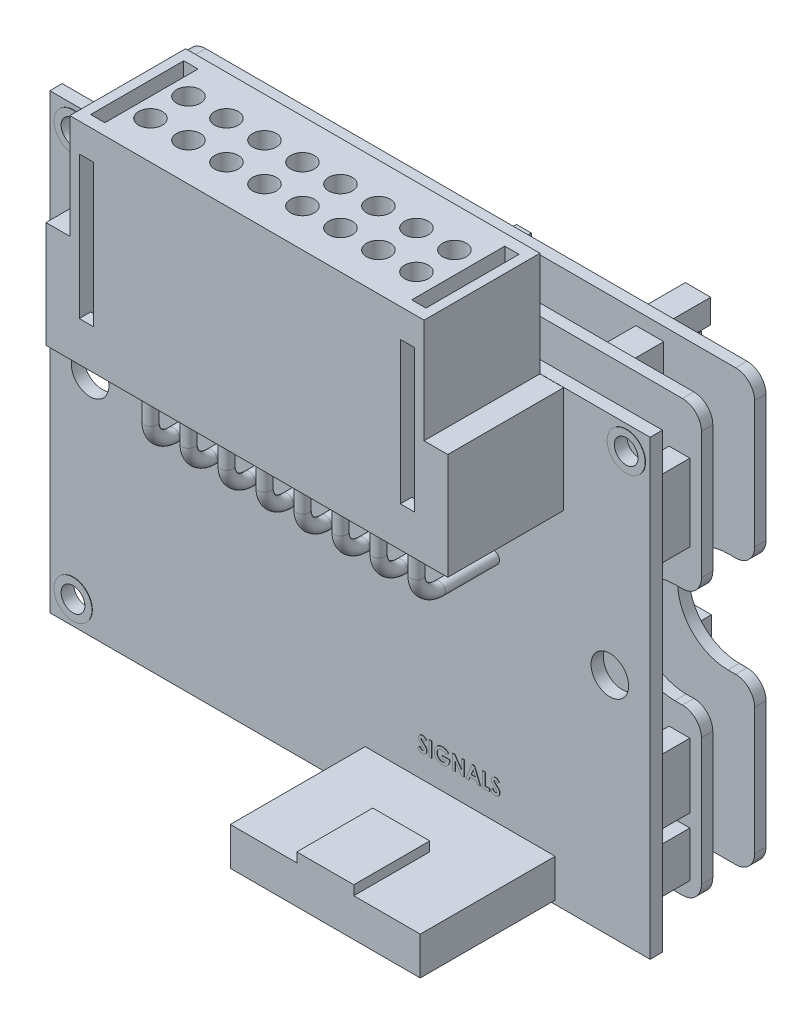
SolidWorks part; units mm, degrees
ref_plane "Front" through (0, 0, 0) normal (0, 0, 1) x (1, 0, 0)
ref_plane "Top" through (0, 0, 0) normal (0, 1, 0) x (1, 0, 0)
ref_plane "Right" through (0, 0, 0) normal (1, 0, 0) x (0, 0, -1)
sketch "Sketch1" plane through (0, 0, 0) normal (0, 0, 1) x (1, 0, 0)
  line L0 (-37.465, -27.4574) -> (37.465, 27.4574) construction
  line L1 (-37.465, 29.9974) -> (37.465, 29.9974)
  line L2 (-40.005, 27.4574) -> (-40.005, -27.4574)
  line L3 (-37.465, -29.9974) -> (37.465, -29.9974)
  line L4 (40.005, 27.4574) -> (40.005, -27.4574)
  arc A0 (-40.005, 27.4574) -> (-37.465, 29.9974) centre (-37.465, 27.4574) cw
  arc A1 (40.005, 27.4574) -> (37.465, 29.9974) centre (37.465, 27.4574) ccw
  arc A2 (37.465, -29.9974) -> (40.005, -27.4574) centre (37.465, -27.4574) ccw
  arc A3 (-40.005, -27.4574) -> (-37.465, -29.9974) centre (-37.465, -27.4574) ccw
  point P6 (-40.005, 29.9974)
  point P12 (40.005, -29.9974)
  dimension "D3" = 2.54
  dimension "D1" = 59.9948
  dimension "D2" = 80.01
extrude "Base-Extrude" add sketch "Sketch1" along normal blind 3.048
sketch "Sketch2" plane through (0, 0, 3.048) normal (0, 0, 1) x (1, 0, 0)
  line L0 (-42.4859, 0) -> (42.2921, 0) construction
  line L1 (0, 33.2814) -> (0, -31.4405) construction
  circle A0 centre (-34.7472, 0) radius 2.2479
  circle A1 centre (34.7472, 0) radius 2.2479
  dimension "D1" = 4.4958
  dimension "D2" = 69.4944
extrude "Cut-Extrude1" cut sketch "Sketch2" against normal up to next
sketch "Sketch3" plane through (0, 0, 3.048) normal (0, 0, 1) x (1, 0, 0)
  line L1 (-21.7516, 17.5854) -> (-18.6512, 17.5854)
  line L2 (-21.7516, 17.5854) -> (-21.7516, 14.8725)
  line L3 (-21.7516, 14.8725) -> (-18.6512, 14.8725)
  line L4 (-18.6512, 17.5854) -> (-18.6512, 14.8725)
  line L5 (-21.7516, -0.8236) -> (-18.748, -0.8236)
  line L6 (-21.7516, -0.8236) -> (-21.7516, -3.8271)
  line L7 (-21.7516, -3.8271) -> (-18.748, -3.8271)
  line L8 (-18.748, -0.8236) -> (-18.748, -3.8271)
  line L9 (-21.7516, -12.2565) -> (-18.5543, -12.2565)
  line L10 (-21.7516, -12.2565) -> (-21.7516, -15.3569)
  line L11 (-21.7516, -15.3569) -> (-18.5543, -15.3569)
  line L12 (-18.5543, -12.2565) -> (-18.5543, -15.3569)
  line L13 (-21.7516, -21.0734) -> (-18.4574, -21.0734)
  line L14 (-21.7516, -21.0734) -> (-21.7516, -24.2707)
  line L15 (-21.7516, -24.2707) -> (-18.4574, -24.2707)
  line L16 (-18.4574, -21.0734) -> (-18.4574, -24.2707)
  line L17 (-1.9862, 22.0423) -> (0, 22.0423)
  line L18 (-1.9862, 22.0423) -> (-1.9862, 16.2289)
  line L19 (-1.9862, 16.2289) -> (0, 16.2289)
  line L20 (0, 22.0423) -> (0, 16.2289)
  line L21 (-1.9862, 2.18) -> (0, 2.18)
  line L22 (-1.9862, 2.18) -> (-1.9862, -4.6991)
  line L23 (-1.9862, -4.6991) -> (0, -4.6991)
  line L24 (0, 2.18) -> (0, -4.6991)
  line L25 (-1.9862, -17.004) -> (0, -17.004)
  line L26 (-1.9862, -17.004) -> (-1.9862, -23.4956)
  line L27 (-1.9862, -23.4956) -> (0, -23.4956)
  line L28 (0, -17.004) -> (0, -23.4956)
  line L29 (20.5889, 26.5961) -> (23.9801, 26.5961)
  line L30 (20.5889, 26.5961) -> (20.5889, 23.3987)
  line L31 (20.5889, 23.3987) -> (23.9801, 23.3987)
  line L32 (23.9801, 26.5961) -> (23.9801, 23.3987)
  line L33 (20.6858, 11.3845) -> (24.3676, 11.3845)
  line L34 (20.6858, 11.3845) -> (20.6858, 8.1871)
  line L35 (20.6858, 8.1871) -> (24.3676, 8.1871)
  line L36 (24.3676, 11.3845) -> (24.3676, 8.1871)
  line L37 (20.6858, 1.7924) -> (22.4298, 1.7924)
  line L38 (20.6858, 1.7924) -> (20.6858, -4.796)
  line L39 (20.6858, -4.796) -> (22.4298, -4.796)
  line L40 (22.4298, 1.7924) -> (22.4298, -4.796)
  line L41 (20.6858, -10.1249) -> (24.0769, -10.1249)
  line L42 (20.6858, -10.1249) -> (20.6858, -13.2254)
  line L43 (20.6858, -13.2254) -> (24.0769, -13.2254)
  line L44 (24.0769, -10.1249) -> (24.0769, -13.2254)
  line L45 (20.6858, -16.6165) -> (22.4298, -16.6165)
  line L46 (20.6858, -16.6165) -> (20.6858, -23.3987)
  line L47 (20.6858, -23.3987) -> (22.4298, -23.3987)
  line L48 (22.4298, -16.6165) -> (22.4298, -23.3987)
  line L49 (20.6858, 22.0423) -> (22.7205, 22.0423)
  line L50 (20.6858, 22.0423) -> (20.6858, 14.8725)
  line L51 (20.6858, 14.8725) -> (22.7205, 14.8725)
  line L52 (22.7205, 22.0423) -> (22.7205, 14.8725)
extrude "Boss-Extrude1" add sketch "Sketch3" along normal blind 6.858
sketch "Sketch4" plane through (0, 0, 9.906) normal (0, 0, 1) x (1, 0, 0)
  line L0 (37.465, 29.9974) -> (-37.465, 29.9974) construction
  line L1 (-36.703, 28.4734) -> (35.687, 28.4734)
  line L2 (-39.243, 25.9334) -> (-39.243, 8.9789)
  line L3 (-36.703, -29.0576) -> (35.687, -29.0576)
  line L4 (38.227, 25.9334) -> (38.227, 8.9789)
  line L5 (-40.005, 27.4574) -> (-40.005, -27.4574) construction
  line L6 (-39.3065, -0.2921) -> (38.1635, -0.2921) construction
  line L7 (-36.703, 6.4389) -> (-35.687, 6.4389)
  line L8 (-36.703, -7.0231) -> (-35.687, -7.0231)
  line L9 (-39.243, -9.5631) -> (-39.243, -26.5176)
  line L10 (-0.508, 32.9907) -> (-0.508, -31.6343) construction
  line L11 (35.687, -7.0231) -> (34.671, -7.0231)
  line L12 (35.687, 6.4389) -> (34.671, 6.4389)
  line L13 (38.227, -9.5631) -> (38.227, -26.5176)
  arc A0 (-35.687, -7.0231) -> (-35.687, 6.4389) centre (-35.687, -0.2921) ccw
  arc A1 (-36.703, 6.4389) -> (-39.243, 8.9789) centre (-36.703, 8.9789) cw
  arc A2 (-36.703, 28.4734) -> (-39.243, 25.9334) centre (-36.703, 25.9334) ccw
  arc A3 (38.227, 25.9334) -> (35.687, 28.4734) centre (35.687, 25.9334) ccw
  arc A4 (35.687, -29.0576) -> (38.227, -26.5176) centre (35.687, -26.5176) ccw
  arc A5 (-39.243, -9.5631) -> (-36.703, -7.0231) centre (-36.703, -9.5631) cw
  arc A6 (-36.703, -29.0576) -> (-39.243, -26.5176) centre (-36.703, -26.5176) cw
  arc A7 (38.227, -9.5631) -> (35.687, -7.0231) centre (35.687, -9.5631) ccw
  arc A8 (34.671, -7.0231) -> (34.671, 6.4389) centre (34.671, -0.2921) cw
  arc A9 (35.687, 6.4389) -> (38.227, 8.9789) centre (35.687, 8.9789) ccw
  point P17 (-39.243, 6.4389)
  point P26 (-39.243, -7.0231)
  dimension "D8" = 2.54
  dimension "D9" = 2.54
  dimension "D1" = 1.524
  dimension "D2" = 0.762
  dimension "D3" = 57.531
  dimension "D4" = 77.47
  dimension "D5" = 3.556
  dimension "D6" = 13.462
  dimension "D7" = 28.7655
  dimension "D10" = 10.287
extrude "Boss-Extrude2" add sketch "Sketch4" along normal blind 1.524
sketch "Sketch5" plane through (0, 0, 11.43) normal (0, 0, 1) x (1, 0, 0)
  line L1 (-38.6103, 22.3329) -> (-35.413, 22.3329)
  line L2 (-38.6103, 22.3329) -> (-38.6103, 19.2325)
  line L3 (-38.6103, 19.2325) -> (-35.413, 19.2325)
  line L4 (-35.413, 22.3329) -> (-35.413, 19.2325)
  line L5 (-38.6103, 14.5818) -> (-35.5099, 14.5818)
  line L6 (-38.6103, 14.5818) -> (-38.6103, 11.3845)
  line L7 (-38.6103, 11.3845) -> (-35.5099, 11.3845)
  line L8 (-35.5099, 14.5818) -> (-35.5099, 11.3845)
  line L9 (-38.6103, -10.7872) -> (-35.6068, -10.7872)
  line L10 (-38.6103, -10.7872) -> (-38.6103, -13.7908)
  line L11 (-38.6103, -13.7908) -> (-35.6068, -13.7908)
  line L12 (-35.6068, -10.7872) -> (-35.6068, -13.7908)
  line L13 (-38.6103, -16.6165) -> (-35.7036, -16.6165)
  line L14 (-38.6103, -16.6165) -> (-38.6103, -19.5232)
  line L15 (-38.6103, -19.5232) -> (-35.7036, -19.5232)
  line L16 (-35.7036, -16.6165) -> (-35.7036, -19.5232)
  line L17 (-38.6103, -22.1392) -> (-35.8005, -22.1392)
  line L18 (-38.6103, -22.1392) -> (-38.6103, -25.7144)
  line L19 (-38.6103, -25.7144) -> (-35.8005, -25.7144)
  line L20 (-35.8005, -22.1392) -> (-35.8005, -25.7144)
  line L21 (-4.1579, 2.6483) -> (3.0273, 2.6483)
  line L22 (-4.1579, 2.6483) -> (-4.1579, -1.3149)
  line L23 (-4.1579, -1.3149) -> (3.0273, -1.3149)
  line L24 (3.0273, 2.6483) -> (3.0273, -1.3149)
  line L25 (-4.1579, -27.6618) -> (0.7703, -27.6618)
  line L26 (-4.1579, -27.6618) -> (-4.1579, -24.1023)
  line L27 (-4.1579, -24.1023) -> (0.7703, -24.1023)
  line L28 (0.7703, -27.6618) -> (0.7703, -24.1023)
  line L29 (24.7642, -27.565) -> (27.875, -27.565)
  line L30 (24.7642, -27.565) -> (24.7642, -24.1023)
  line L31 (24.7642, -24.1023) -> (27.875, -24.1023)
  line L32 (27.875, -27.565) -> (27.875, -24.1023)
  line L33 (22.3582, 26.6875) -> (26.0708, 26.6875)
  line L34 (22.3582, 26.6875) -> (22.3582, 22.6236)
  line L35 (22.3582, 22.6236) -> (26.0708, 22.6236)
  line L36 (26.0708, 26.6875) -> (26.0708, 22.6236)
extrude "Boss-Extrude3" add sketch "Sketch5" along normal blind 5.588
pattern_linear "LPattern1" count 2 spacing 7.112
sketch "Sketch6" plane through (0, 0, 18.542) normal (0, 0, 1) x (1, 0, 0)
  line L1 (-33.9596, 20.4921) -> (-30.8592, 20.4921)
  line L2 (-33.9596, 20.4921) -> (-33.9596, 12.644)
  line L3 (-33.9596, 12.644) -> (-30.8592, 12.644)
  line L4 (-30.8592, 20.4921) -> (-30.8592, 12.644)
  line L5 (-33.9596, -10.3592) -> (-30.8592, -10.3592)
  line L6 (-33.9596, -10.3592) -> (-33.9596, -24.1372)
  line L7 (-33.9596, -24.1372) -> (-30.8592, -24.1372)
  line L8 (-30.8592, -10.3592) -> (-30.8592, -24.1372)
  line L9 (36.687, 22.0601) -> (33.9093, 22.0601)
  line L10 (36.687, 22.0601) -> (36.687, 11.7833)
  line L11 (36.687, 11.7833) -> (33.9093, 11.7833)
  line L12 (33.9093, 22.0601) -> (33.9093, 11.7833)
  line L13 (36.687, -10.3592) -> (33.9093, -10.3592)
  line L14 (36.687, -10.3592) -> (36.687, -19.0173)
  line L15 (36.687, -19.0173) -> (33.9093, -19.0173)
  line L16 (33.9093, -10.3592) -> (33.9093, -19.0173)
  line L17 (33.9093, -20.7669) -> (36.687, -20.7669)
  line L18 (33.9093, -20.7669) -> (33.9093, -26.8595)
  line L19 (33.9093, -26.8595) -> (36.687, -26.8595)
  line L20 (36.687, -20.7669) -> (36.687, -26.8595)
extrude "Boss-Extrude4" add sketch "Sketch6" along normal blind 6.985
sketch "Sketch7" plane through (0, 0, 25.527) normal (0, 0, 1) x (1, 0, 0)
  line L1 (-40.259, 30.4546) -> (40.005, 30.4546)
  line L2 (-40.259, 30.4546) -> (-40.259, -29.9974)
  line L3 (-40.259, -29.9974) -> (40.005, -29.9974)
  line L4 (40.005, 30.4546) -> (40.005, -29.9974)
  line L6 (40.005, -27.4574) -> (40.005, 27.4574) construction
  line L7 (-37.465, -29.9974) -> (37.465, -29.9974) construction
  dimension "D1" = 60.452
  dimension "D2" = 80.264
extrude "Boss-Extrude5" add sketch "Sketch7" along normal blind 1.651
sketch "Sketch8" plane through (0, 0, 27.178) normal (0, 0, 1) x (1, 0, 0)
  line L0 (-40.259, 0.2286) -> (40.005, 0.2286) construction
  line L1 (-40.259, 30.4546) -> (-40.259, -29.9974) construction
  line L2 (40.005, -29.9974) -> (40.005, 30.4546) construction
  line L3 (-0.127, 30.4546) -> (-0.127, -29.9974) construction
  line L4 (40.005, 30.4546) -> (-40.259, 30.4546) construction
  line L5 (-40.259, -29.9974) -> (40.005, -29.9974) construction
  circle A0 centre (-34.8742, 0.2286) radius 2.5146
  circle A1 centre (34.6202, 0.2286) radius 2.5146
  dimension "D1" = 5.0292
  dimension "D2" = 69.4944
extrude "Cut-Extrude2" cut sketch "Sketch8" against normal up to next
sketch "Sketch9" plane through (0, 0, 27.178) normal (0, 0, 1) x (1, 0, 0)
  line L0 (40.005, 30.4546) -> (-40.259, 30.4546) construction
  line L1 (-25.273, 30.4292) -> (28.448, 30.4292)
  line L2 (-25.273, 30.4292) -> (-25.273, 16.2052)
  line L3 (-25.273, 16.2052) -> (28.448, 16.2052)
  line L4 (28.448, 30.4292) -> (28.448, 16.2052)
  line L5 (-40.259, 30.4546) -> (-40.259, -29.9974) construction
  dimension "D1" = 0.0254
  dimension "D2" = 53.721
  dimension "D3" = 14.224
  dimension "D4" = 14.986
extrude "Boss-Extrude6" add sketch "Sketch9" along normal blind 15.494
sketch "Sketch10" plane through (0, 30.4292, 0) normal (0, 1, 0) x (-1, 0, 0)
  line L1 (-28.448, 42.672) -> (25.273, 42.672) construction
  line L3 (-25.273, 42.672) -> (22.098, 42.672)
  line L4 (-25.273, 42.672) -> (-25.273, 27.178)
  line L5 (-25.273, 27.178) -> (22.098, 27.178)
  line L6 (22.098, 42.672) -> (22.098, 27.178)
  line L7 (25.273, 27.178) -> (-28.448, 42.672) construction
  line L8 (-25.273, 27.178) -> (22.098, 42.672) construction
  point P8 (-1.5875, 34.925)
  dimension "D1" = 47.371
extrude "Boss-Extrude7" add sketch "Sketch10" along normal blind 13.97
ref_plane "Plane1" through (19.05, 0, 0) normal (1, 0, 0) x (0, 0, -1)
sketch "Sketch11" plane through (19.05, 0, 0) normal (1, 0, 0) x (0, 0, -1)
  line L0 (-37.465, 16.2052) -> (-37.465, 9.1694)
  line L1 (-42.672, 16.2052) -> (-27.178, 16.2052) construction
  line L2 (-34.417, 6.1214) -> (-27.178, 6.1214)
  line L3 (-27.178, -29.9974) -> (-27.178, 30.4546) construction
  line L4 (-42.672, 16.2052) -> (-42.672, 30.4292) construction
  arc A0 (-34.417, 6.1214) -> (-37.465, 9.1694) centre (-34.417, 9.1694) cw
  dimension "D3" = 3.048
  dimension "D1" = 5.207
  dimension "D2" = 10.0838
sketch "Sketch12" plane through (0, 16.2052, 0) normal (0, -1, 0) x (1, 0, 0)
  circle A0 centre (19.05, 37.465) radius 0.8128
  dimension "D1" = 1.6256
sweep "Boss-Sweep1" add profiles "Sketch12" path "Sketch11"
sketch "Sketch13" plane through (19.05, 0, 0) normal (1, 0, 0) x (0, 0, -1)
  line L0 (-32.385, 16.2052) -> (-32.385, 14.2494)
  line L1 (-42.672, 16.2052) -> (-27.178, 16.2052) construction
  line L2 (-29.337, 11.2014) -> (-27.178, 11.2014)
  line L3 (-27.178, -29.9974) -> (-27.178, 30.4546) construction
  line L4 (-34.417, 6.1214) -> (-27.178, 6.1214) construction
  line L5 (-37.465, 9.1694) -> (-37.465, 16.2052) construction
  arc A0 (-29.337, 11.2014) -> (-32.385, 14.2494) centre (-29.337, 14.2494) cw
  dimension "D3" = 3.048
  dimension "D1" = 5.08
  dimension "D2" = 5.08
sketch "Sketch14" plane through (0, 16.2052, 0) normal (0, -1, 0) x (1, 0, 0)
  circle A0 centre (19.05, 32.385) radius 0.8128
  dimension "D1" = 1.6256
pattern_linear "LPattern2" count 8 spacing 5.08
sweep "Boss-Sweep2" add profiles "Sketch14" path "Sketch13"
pattern_linear "LPattern3" count 8 spacing 5.08
sketch "Sketch16" plane through (0, 0, 27.178) normal (0, 0, 1) x (1, 0, 0)
  line L0 (40.005, -29.9974) -> (40.005, 30.4546) construction
  line L1 (1.905, -24.4094) -> (27.305, -24.4094)
  line L2 (1.905, -24.4094) -> (1.905, -29.4894)
  line L3 (1.905, -29.4894) -> (27.305, -29.4894)
  line L4 (27.305, -24.4094) -> (27.305, -29.4894)
  line L5 (-40.259, -29.9974) -> (40.005, -29.9974) construction
  dimension "D1" = 5.08
  dimension "D2" = 25.4
  dimension "D3" = 12.7
  dimension "D4" = 0.508
extrude "Boss-Extrude8" add sketch "Sketch16" along normal blind 18.034
sketch "Sketch17" plane through (0, 0, 45.212) normal (0, 0, 1) x (1, 0, 0)
  line L0 (14.605, -29.4894) -> (14.605, -19.0816) construction
  line L1 (27.305, -24.4094) -> (1.905, -24.4094) construction
  line L3 (18.415, -24.4094) -> (10.795, -24.4094)
  line L4 (10.795, -24.4094) -> (10.795, -23.1394)
  line L5 (10.795, -23.1394) -> (18.415, -23.1394)
  line L6 (1.905, -29.4894) -> (27.305, -29.4894) construction
  line L7 (18.415, -24.4094) -> (18.415, -23.1394)
  point P11 (14.605, -23.1394)
  point P12 (14.605, -24.4094)
  dimension "D1" = 7.62
  dimension "D2" = 1.27
extrude "Boss-Extrude9" add sketch "Sketch17" against normal blind 10.16
sketch "Sketch18" plane through (0, 0, 27.178) normal (0, 0, 1) x (1, 0, 0)
  line L0 (40.005, 0.2286) -> (-40.259, 0.2286) construction
  line L1 (40.005, -29.9974) -> (40.005, 30.4546) construction
  line L2 (-40.259, 30.4546) -> (-40.259, -29.9974) construction
  line L3 (-0.127, -29.9974) -> (-0.127, 49.4652) construction
  line L4 (-40.259, -29.9974) -> (40.005, -29.9974) construction
  circle A0 centre (-37.1094, 27.2796) radius 1.5875
  circle A1 centre (-37.1094, -26.8224) radius 1.5875
  circle A2 centre (36.8554, 27.2796) radius 1.5875
  dimension "D1" = 3.175
  dimension "D2" = 54.102
  dimension "D3" = 73.9648
extrude "Cut-Extrude3" cut sketch "Sketch18" against normal up to next
sketch "Sketch19" plane through (0, 0, 27.178) normal (0, 0, 1) x (1, 0, 0)
  circle A0 centre (36.8554, 27.2796) radius 1.5875 construction
  circle A1 centre (-37.1094, -26.8224) radius 1.5875 construction
  circle A2 centre (-37.1094, 27.2796) radius 1.5875 construction
  circle A18 centre (36.8554, 27.2796) radius 1.5875
  circle A19 centre (-37.1094, -26.8224) radius 1.5875
  circle A20 centre (-37.1094, 27.2796) radius 1.5875
  circle A21 centre (-37.1094, 27.2796) radius 2.54
  circle A22 centre (-37.1094, -26.8224) radius 2.54
  circle A23 centre (36.8554, 27.2796) radius 2.54
  dimension "D1" = 5.08
extrude "Boss-Extrude10" add sketch "Sketch19" along normal blind 0.0508
sketch "Sketch20" plane through (0, 44.3992, 0) normal (0, 1, 0) x (-1, 0, 0)
  line L0 (22.098, 42.672) -> (-25.273, 42.672) construction
  line L2 (-25.273, 42.672) -> (-25.273, 27.178) construction
  circle A0 centre (-19.177, 37.592) radius 1.5875
  dimension "D1" = 3.175
  dimension "D2" = 5.08
  dimension "D3" = 6.096
extrude "Cut-Extrude4" cut sketch "Sketch20" against normal blind 25.4
pattern_linear "LPattern4" count 8 spacing 5.08 count 2 spacing 5.08
sketch "Sketch21" plane through (0, 44.3992, 0) normal (0, 1, 0) x (-1, 0, 0)
  line L0 (-25.273, 42.672) -> (-25.273, 27.178) construction
  line L1 (-24.003, 28.702) -> (-22.098, 28.702)
  line L2 (-24.003, 28.702) -> (-24.003, 41.148)
  line L3 (-24.003, 41.148) -> (-22.098, 41.148)
  line L4 (-22.098, 28.702) -> (-22.098, 41.148)
  line L5 (22.098, 42.672) -> (-25.273, 42.672) construction
  line L6 (-1.5875, 42.672) -> (-1.5875, 27.178) construction
  line L7 (18.923, 28.702) -> (18.923, 41.148)
  line L8 (20.828, 41.148) -> (18.923, 41.148)
  line L9 (20.828, 28.702) -> (20.828, 41.148)
  line L10 (20.828, 28.702) -> (18.923, 28.702)
  dimension "D1" = 12.446
  dimension "D2" = 1.27
  dimension "D3" = 1.524
  dimension "D4" = 1.905
extrude "Cut-Extrude5" cut sketch "Sketch21" against normal blind 25.4
sketch "Sketch22" plane through (0, 0, 42.672) normal (0, 0, 1) x (1, 0, 0)
  line L0 (25.273, 44.3992) -> (25.273, 30.4292) construction
  line L1 (22.098, 40.5892) -> (24.003, 40.5892)
  line L2 (22.098, 40.5892) -> (22.098, 21.5392)
  line L3 (22.098, 21.5392) -> (24.003, 21.5392)
  line L4 (24.003, 40.5892) -> (24.003, 21.5392)
  line L5 (-22.098, 44.3992) -> (25.273, 44.3992) construction
  line L6 (1.5875, 44.3992) -> (1.5875, -12.2178) construction
  line L7 (-20.828, 40.5892) -> (-20.828, 21.5392)
  line L8 (-18.923, 21.5392) -> (-20.828, 21.5392)
  line L9 (-18.923, 40.5892) -> (-18.923, 21.5392)
  line L10 (-18.923, 40.5892) -> (-20.828, 40.5892)
  dimension "D1" = 1.27
  dimension "D2" = 19.05
  dimension "D3" = 3.81
  dimension "D4" = 1.905
extrude "Cut-Extrude6" cut sketch "Sketch22" against normal up to surface (15.494 mm away)
sketch "Sketch23" plane through (0, 0, 27.178) normal (0, 0, 1) x (1, 0, 0)
  line L0 (-34.671, 33.045) -> (-34.671, 7.6589) construction
  line L1 (-22.098, 30.4546) -> (-40.259, 30.4546) construction
  line L2 (-40.259, 30.4546) -> (-40.259, -29.9974) construction
  circle A0 centre (-34.671, 20.2946) radius 0.635
  circle A1 centre (-34.671, 16.7386) radius 0.635
  dimension "D1" = 1.27
  dimension "D2" = 10.16
  dimension "D3" = 5.588
  dimension "D4" = 3.556
extrude "Cut-Extrude7" cut sketch "Sketch23" against normal blind 2.54
sketch "Sketch24" plane through (0, 0, 27.178) normal (0, 0, 1) x (1, 0, 0)
  line L0 (-35.941, 15.4686) -> (-33.401, 18.0086) construction
  line L1 (-35.941, 18.0086) -> (-33.401, 18.0086)
  line L2 (-35.941, 18.0086) -> (-35.941, 15.4686)
  line L3 (-35.941, 15.4686) -> (-33.401, 15.4686)
  line L4 (-33.401, 18.0086) -> (-33.401, 15.4686)
  circle A0 centre (-34.671, 16.7386) radius 0.635 construction
  circle A1 centre (-34.671, 16.7386) radius 0.635
  circle A2 centre (-34.671, 20.2946) radius 0.635 construction
  circle A3 centre (-34.671, 20.2946) radius 0.635
  circle A4 centre (-34.671, 20.2946) radius 1.27
  point P0 (-34.671, 16.7386)
  dimension "D2" = 2.54
  dimension "D1" = 2.54
extrude "Boss-Extrude11" add sketch "Sketch24" along normal blind 0.0508
sketch "Sketch26" plane through (0, 0, 27.178) normal (0, 0, 1) x (1, 0, 0)
  line L1 (8.89, 9.1694) -> (8.89, 16.2052) construction
  text T0 "<b>CAP BANK  </b>" font "Century Gothic" height in points 8
  text T1 "<b>SIGNALS</b>" font "Century Gothic" height in points 8
extrude "Boss-Extrude12" add sketch "Sketch26" along normal blind 0.0508
sketch "Sketch27" plane through (-40.005, 0, 0) normal (-1, 0, 0) x (0, 0, 1)
  line L0 (3.048, 27.4574) -> (3.048, -27.4574) construction
  line L1 (3.048, 36.4272) -> (0, 36.4272)
  line L2 (3.048, 36.4272) -> (3.048, -32.721)
  line L3 (3.048, -32.721) -> (0, -32.721)
  line L4 (0, 36.4272) -> (0, -32.721)
  line L5 (0, 27.4574) -> (0, -27.4574) construction
extrude "Cut-Remove Base" cut sketch "Sketch27" against normal through all
